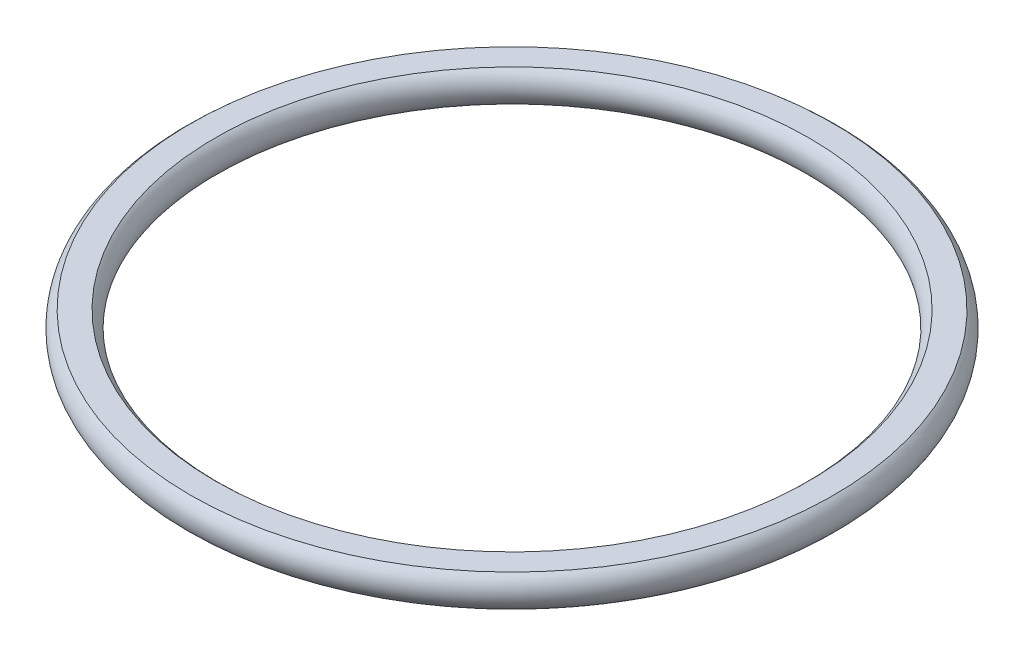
SolidWorks part; units mm, degrees
ref_plane "Front Plane" through (0, 0, 0) normal (0, 0, 1) x (1, 0, 0)
ref_plane "Top Plane" through (0, 0, 0) normal (0, 1, 0) x (1, 0, 0)
ref_plane "Right Plane" through (0, 0, 0) normal (1, 0, 0) x (0, 0, -1)
sketch "Sketch1" plane through (0, 0, 0) normal (0, 0, 1) x (1, 0, 0)
  line L0 (0, 10.5915) -> (-25, 10.5915)
  line L1 (10.2889, 10.5915) -> (-10.2889, 10.5915)
  line L2 (0, 10.5915) -> (0, 0) construction
  line L3 (-25, 10.5915) -> (-28.5, 10.5915)
  circle A0 centre (-26.75, 10.5915) radius 1.75
  point P2 (0, 10.5915)
  dimension "D1" = 25
  dimension "D2" = 3.5
revolve "Revolve1" add sketch "Sketch1" angle 360 about L2
sketch "Sketch2" plane through (0, 38.6485, 0) normal (0, 1, 0) x (1, 0, 0)
  line L1 (-40.6357, 35.2092) -> (40.6357, 35.2092)
  line L2 (-40.6357, 35.2092) -> (-40.6357, -35.2092)
  line L3 (-40.6357, -35.2092) -> (40.6357, -35.2092)
  line L4 (40.6357, 35.2092) -> (40.6357, -35.2092)
  line L5 (-40.6357, 35.2092) -> (40.6357, -35.2092) construction
  line L6 (-40.6357, -35.2092) -> (40.6357, 35.2092) construction
extrude "Cut-Extrude1" cut sketch "Sketch2" against normal blind 26.67
